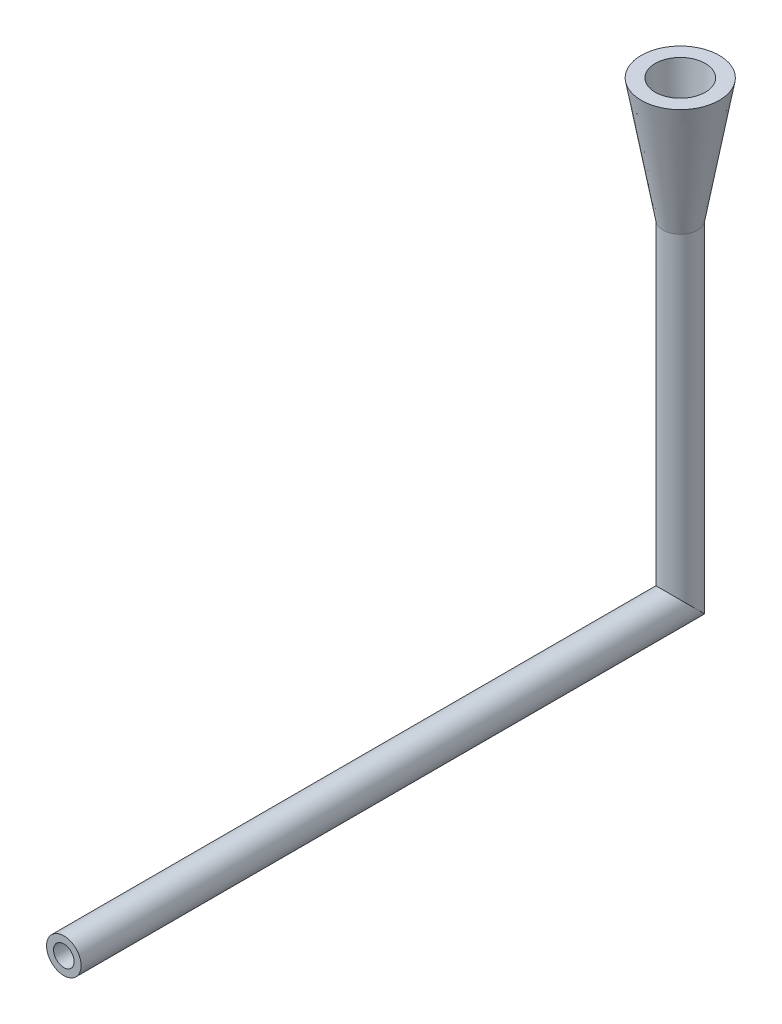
SolidWorks part; units mm, degrees
ref_plane "Front Plane" through (0, 0, 0) normal (0, 0, 1) x (1, 0, 0)
ref_plane "Top Plane" through (0, 0, 0) normal (0, 1, 0) x (1, 0, 0)
ref_plane "Right Plane" through (0, 0, 0) normal (1, 0, 0) x (0, 0, -1)
sketch "Sketch1" plane through (0, 0, 0) normal (0, 0, 1) x (1, 0, 0)
  circle A0 centre (0, 0) radius 6.35
  circle A1 centre (0, 0) radius 10.668
  dimension "D1" = 21.336
  dimension "D2" = 12.7
sketch "Sketch2" plane through (0, 0, 0) normal (1, 0, 0) x (0, 0, -1)
  line L0 (0, 0) -> (381, 0)
  line L1 (381, 0) -> (381, 203.2)
  dimension "D1" = 381
  dimension "D2" = 203.2
sweep "Sweep1" add profiles "Sketch1" path "Sketch2"
sketch "Sketch3" plane through (0, 203.2, 0) normal (0, 1, 0) x (1, 0, 0)
  circle A1 centre (0, 381) radius 10.668
  circle A2 centre (0, 381) radius 10.668 construction
extrude "Boss-Extrude1" add sketch "Sketch3" along normal blind 76.2 draft 10
sketch "Sketch5" plane through (0, 279.4, 0) normal (0, 1, 0) x (1, 0, 0)
  circle A0 centre (0, 381) radius 15.4681
  circle A1 centre (0, 381) radius 24.1041 construction
  dimension "D1" = 8.636
extrude "Cut-Extrude1" cut sketch "Sketch5" against normal blind 76.2 draft 6
